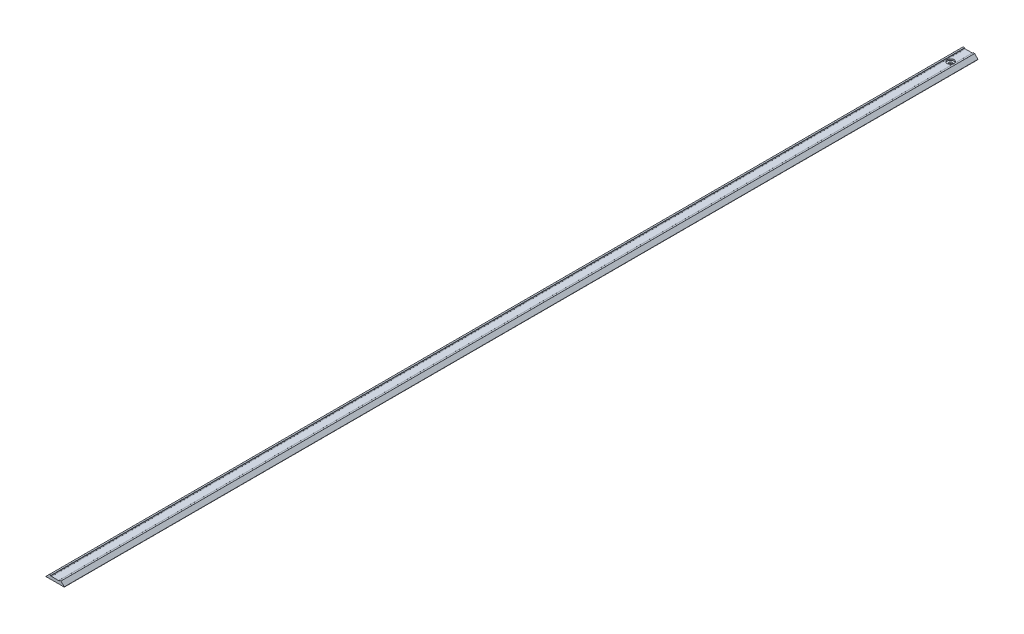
SolidWorks part; units mm, degrees
ref_plane "Front Plane" through (0, 0, 0) normal (0, 0, 1) x (1, 0, 0)
ref_plane "Top Plane" through (0, 0, 0) normal (0, 1, 0) x (1, 0, 0)
ref_plane "Right Plane" through (0, 0, 0) normal (1, 0, 0) x (0, 0, -1)
sketch "Sketch1" plane through (0, 0, 0) normal (0, 0, 1) x (1, 0, 0)
  line L0 (0.1, 0) -> (3, 0)
  line L1 (0, 0.1) -> (0, 0.2586)
  line L2 (0.0293, 0.3293) -> (3.6707, 3.9707)
  line L3 (3.7414, 4) -> (5.35, 4)
  line L4 (5.5, 3.85) -> (5.5, 3.75)
  line L5 (5.35, 3.6) -> (5.025, 3.6)
  line L6 (4.875, 3.45) -> (4.875, 3.4)
  line L7 (5.025, 3.25) -> (6, 3.25)
  line L8 (15.125, 3.4) -> (15.125, 3.45)
  line L9 (14.975, 3.6) -> (14.65, 3.6)
  line L10 (14.5, 3.75) -> (14.5, 3.85)
  line L11 (14.65, 4) -> (16.2586, 4)
  line L12 (16.3293, 3.9707) -> (19.9707, 0.3293)
  line L13 (20, 0.2586) -> (20, 0.1)
  line L14 (19.9, 0) -> (17, 0)
  line L15 (17, 0) -> (17, 0.05)
  line L16 (17, 0.05) -> (3, 0.05)
  line L17 (3, 0.05) -> (3, 0)
  line L18 (14, 3.25) -> (14.975, 3.25)
  line L19 (0, 0) -> (0.801, 0) construction
  line L20 (6, 3.25) -> (6, 3.2)
  line L21 (6, 3.2) -> (9.9, 3.2)
  line L22 (14, 3.25) -> (14, 3.2)
  line L23 (0, 0) -> (0, 0.3) construction
  line L24 (9.9, 3.2) -> (14, 3.2)
  line L25 (0, 0.3) -> (0.2634, 0.5634) construction
  arc A0 (5.025, 3.6) -> (4.875, 3.45) centre (5.025, 3.45) ccw
  arc A1 (5.025, 3.25) -> (4.875, 3.4) centre (5.025, 3.4) cw
  arc A2 (5.5, 3.75) -> (5.35, 3.6) centre (5.35, 3.75) cw
  arc A3 (5.35, 4) -> (5.5, 3.85) centre (5.35, 3.85) cw
  arc A4 (15.125, 3.4) -> (14.975, 3.25) centre (14.975, 3.4) cw
  arc A5 (14.975, 3.6) -> (15.125, 3.45) centre (14.975, 3.45) cw
  arc A6 (14.5, 3.75) -> (14.65, 3.6) centre (14.65, 3.75) ccw
  arc A7 (14.65, 4) -> (14.5, 3.85) centre (14.65, 3.85) ccw
  arc A8 (20, 0.1) -> (19.9, 0) centre (19.9, 0.1) cw
  arc A9 (19.9707, 0.3293) -> (20, 0.2586) centre (19.9, 0.2586) cw
  arc A10 (16.3293, 3.9707) -> (16.2586, 4) centre (16.2586, 3.9) ccw
  arc A11 (3.6707, 3.9707) -> (3.7414, 4) centre (3.7414, 3.9) cw
  arc A12 (0.0293, 0.3293) -> (0, 0.2586) centre (0.1, 0.2586) ccw
  arc A13 (0.1, 0) -> (0, 0.1) centre (0.1, 0.1) cw
  point P42 (20, 0)
  point P45 (20, 0.3)
  point P52 (0, 0.3)
  point P55 (0, 0)
  dimension "D17" = 0.15
  dimension "D19" = 3.2
  dimension "D24" = 0.1
  dimension "D1" = 20
  dimension "D2" = 3
  dimension "D3" = 3
  dimension "D4" = 0.3
  dimension "D5" = 0.3
  dimension "D6" = 0.05
  dimension "D7" = 4
  dimension "D8" = 4
  dimension "D9" = 10.25
  dimension "D10" = 4.875
  dimension "D11" = 0.75
  dimension "D12" = 0.35
  dimension "D13" = 0.35
  dimension "D14" = 9
  dimension "D15" = 0.625
  dimension "D16" = 135
  dimension "D18" = 4.875
  dimension "D20" = 0.625
  dimension "D21" = 8
  dimension "D22" = 6
  dimension "D23" = 0.05
extrude "Extrude1" add sketch "Sketch1" along normal blind 1000
hole_wizard "CBORE for M3 Hex Socket Head Cap Screw1" positions "Sketch5" profile "Sketch4" counterbore size "M3" standard "DIN"
sketch "Sketch5" plane through (0, 3.2, 0) normal (0, 1, 0) x (-1, 0, 0)
  line L0 (-14, 0) -> (-6, 0) construction
  line L1 (0, 1000) -> (0, 0) construction
  point P0 (-10, 20)
  dimension "D1" = 20
  dimension "D2" = 10
sketch "Sketch4" plane through (10, 3.2, 20) normal (1, 0, 0) x (0, 0, 1)
  line L0 (0, 0) -> (0, 3.2)
  line L1 (0, 3.2) -> (1.7, 3.2)
  line L3 (1.7, 3.2) -> (1.7, 1.5)
  line L4 (1.7, 1.5) -> (3.75, 1.5)
  line L5 (3.75, 1.5) -> (3.75, 0)
  line L7 (3.75, 0) -> (0, 0)
  line L11 (0, -6.35) -> (0, 107.95) construction
  dimension "Thru Hole Dia." = 3.4
  dimension "Thru Hole Depth" = 3.2
  dimension "C'Bore Dia." = 7.5
  dimension "C'Bore Depth" = 1.5
